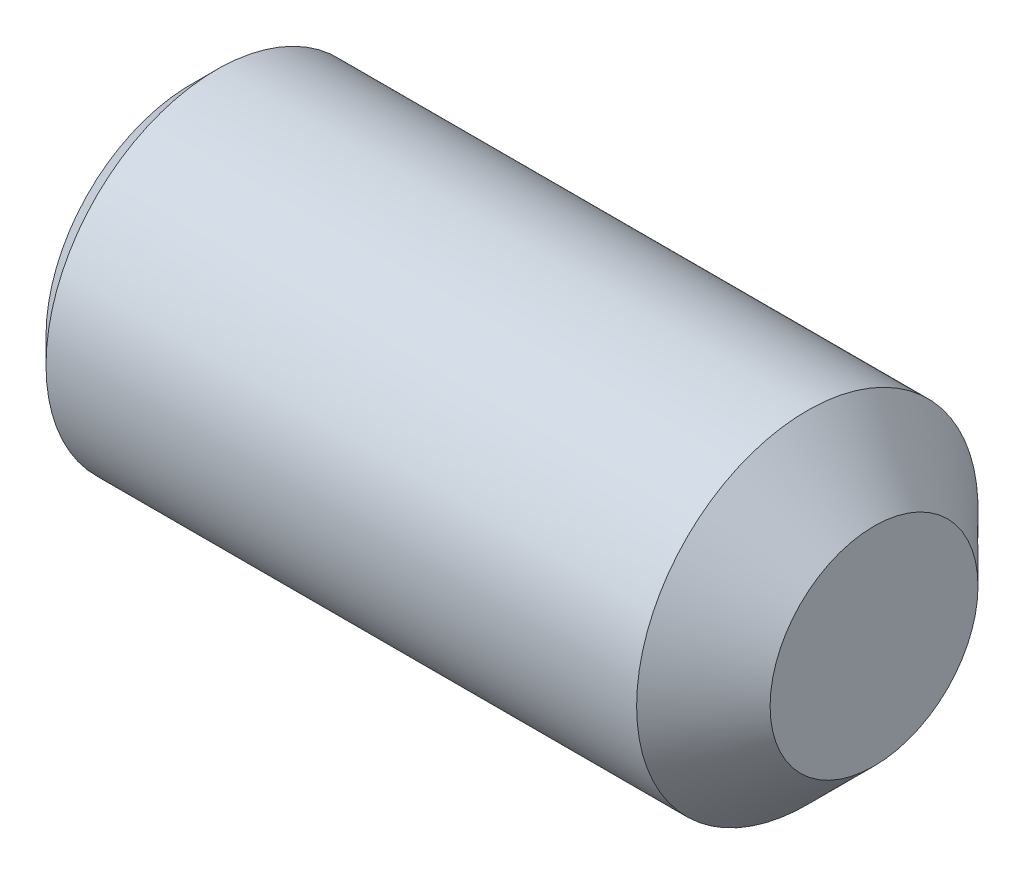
SolidWorks part; units mm, degrees
ref_plane "Plane1" through (0, 0, 0) normal (0, 0, 1) x (1, 0, 0)
ref_plane "Plane2" through (0, 0, 0) normal (0, 1, 0) x (1, 0, 0)
ref_plane "Plane3" through (0, 0, 0) normal (1, 0, 0) x (0, 0, -1)
sketch "BodySke" plane through (0, 0, 0) normal (0, 0, 1) x (1, 0, 0)
  line L0 (0, 0) -> (0, 10.8102)
  line L1 (0, 10.8102) -> (1.8898, 12.7)
  line L2 (1.8898, 12.7) -> (45.8343, 12.7)
  line L3 (45.8343, 12.7) -> (50.8, 7.7343)
  line L4 (50.8, 0) -> (0, 0)
  line L5 (-12.7, 0) -> (88.9, 0) construction
  line L6 (50.8, 7.7343) -> (50.8, 0)
  line L7 (50.8, 7.7343) -> (50.8, 17.2593) construction
  line L8 (0, -10.8102) -> (1.8898, -12.7) construction
  line L9 (2.1082, 15.875) -> (2.1082, -3.175) construction
  line L10 (45.8343, -12.7) -> (50.8, -7.7343) construction
  dimension "Length" = 50.8
  dimension "Diameter" = 25.4
  dimension "Drive_ch_ang" = 45
  dimension "Minor_dia" = 21.6205
  dimension "Cup_nose_ang" = 45
  dimension "Cup_dia" = 15.4686
  dimension "Advance" = 2.1082
revolve "BaseBody" add sketch "BodySke" angle 360 about L5
sketch "Sketch2" plane through (0, 0, 0) normal (-1, 0, 0) x (0, 0, 1)
  line L0 (4.1208, 7.1374) -> (-4.1208, 7.1374)
  line L1 (-4.1208, 7.1374) -> (-8.2416, 0)
  line L2 (4.1208, 7.1374) -> (8.2416, 0)
  line L3 (4.1208, -7.1374) -> (8.2416, 0)
  line L4 (4.1208, -7.1374) -> (-4.1208, -7.1374)
  line L5 (-4.1208, -7.1374) -> (-8.2416, 0)
  dimension "Hex_size" = 14.2748
  dimension "D2" = 7.1374
  dimension "D3" = 7.1374
extrude "Hex" cut sketch "Sketch2" against normal blind 14.2748
sketch "Sketch4" plane through (0, 4.7709, -0.5249) normal (-1, 0, 0) x (0, 0, 1)
  line L0 (0.5249, -4.7709) -> (10.6976, -4.7709)
  line L1 (0.5249, -4.7709) -> (6.6732, -1.2211) construction
  line L2 (0.5249, -4.7709) -> (5.6112, 4.0389)
  line L3 (8.9666, -2.6687) -> (10.2861, -1.9069)
  line L4 (6.5663, 1.4888) -> (7.8858, 2.2506)
  arc A0 (8.9666, -2.6687) -> (6.5663, 1.4888) centre (0.5249, -4.7709) ccw
  arc A1 (10.6976, -4.7709) -> (10.2861, -1.9069) centre (0.5249, -4.7709) ccw
  arc A2 (5.6112, 4.0389) -> (7.8858, 2.2506) centre (0.5249, -4.7709) cw
  circle A3 centre (0.5249, -4.7709) radius 8.6995 construction
  circle A4 centre (0.5249, -4.7709) radius 10.1727 construction
  dimension "D1" = 30
  dimension "Spline_n_dim" = 17.399
  dimension "Spline_m_dim" = 20.3454
  dimension "Spline_a_dim" = 60
  dimension "D3" = 2.4003
  dimension "Spline_p_dim" = 4.8006
extrude "Spline" [suppressed] cut sketch "Sketch4" against normal blind 12.7
pattern_circular "CirPattern1" [suppressed] count 6 every 60 about axis through (-12.7, 0, 0) along (1, 0, 0)
sketch "ThdSchSke" plane through (0, 0, 0) normal (0, 0, 1) x (1, 0, 0)
  line L0 (1.8898, -10.8102) -> (0.5665, -12.7)
  line L1 (1.8898, -10.8102) -> (3.213, -12.7)
  line L2 (3.213, -12.7) -> (3.213, -15.875)
  line L3 (-3.175, 0) -> (5.1513, 0) construction
  line L4 (1.8898, 12.7) -> (1.8898, -12.7) construction
  line L5 (3.213, -15.875) -> (0.5665, -15.875)
  line L6 (0.5665, -15.875) -> (0.5665, -12.7)
  dimension "Thread_minor" = 21.6205
  dimension "Diameter" = 25.4
  dimension "SideAngle" = 55
  dimension "VeeAngle" = 70
  dimension "Overcut" = 31.75
revolve "ThreadSchematic" [suppressed] cut sketch "ThdSchSke" angle 360 about L3
pattern_linear "ThdSchPat" [suppressed]
equation "\"D2@Sketch2\" = \"Hex_size@Sketch2\" / 2"
equation "\"D3@Sketch2\" = \"Hex_size@Sketch2\" / 2"
equation "\"Thread_minor@ThreadCosmetic\" = \"Minor_dia@BodySke\""
equation "\"D1@Sketch4\" = \"Spline_a_dim@Sketch4\" / 2"
equation "\"D3@Sketch4\" = \"Spline_p_dim@Sketch4\" / 2"
equation "\"D2@CirPattern1\" = \"Spline_a_dim@Sketch4\""
equation "\"Num_teeth@CirPattern1\" = 360 / \"D2@CirPattern1\""
equation "\"Thread_minor@ThdSchSke\" = \"Thread_minor@ThreadCosmetic\""
equation "\"Diameter@ThdSchSke\" = \"Diameter@BodySke\""
equation "\"Overcut@ThdSchSke\" = \"Diameter@BodySke\" * 1.25"
equation "\"Num_threads@ThdSchPat\" = int( (\"Length@BodySke\" - ( ( ( \"Diameter@BodySke\" - \"Minor_dia@BodySke\" ) * 0.5 ) / tan( \"Drive_ch_ang@BodySke\" * 0.017453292 ) ) - ( ( ( \"Diameter@BodySke\" - \"Cup_dia@BodySk"
equation "\"Advance@ThdSchPat\" = (\"Length@BodySke\" - ( ( ( \"Diameter@BodySke\" - \"Minor_dia@BodySke\" ) * 0.5 ) / tan( \"Drive_ch_ang@BodySke\" * 0.017453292 ) ) - ( ( ( \"Diameter@BodySke\" - \"Cup_dia@BodySke\" ) * 0."
equation "' \"Num_threads@ThdSchPat\" = \"Num_threads@ThdSchPat\" - sgn( \"Num_threads@ThdSchPat\" - 1) '---chamfered tips only---"
